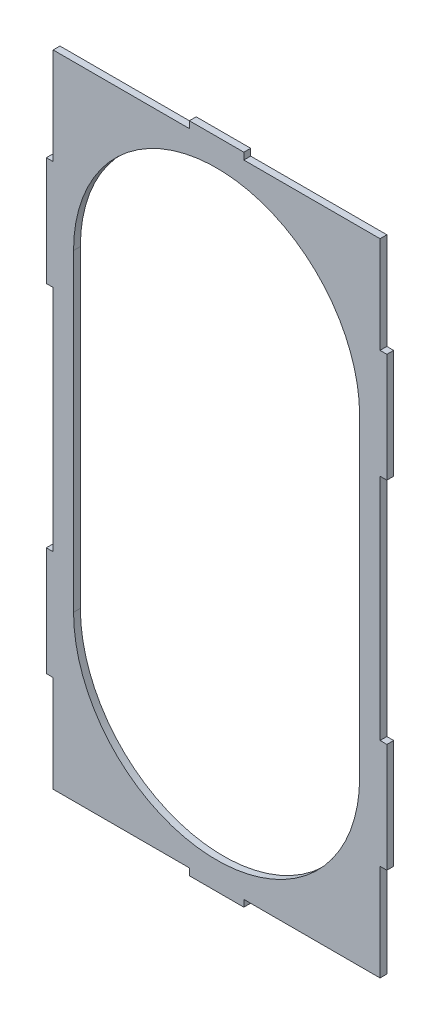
SolidWorks part; units mm, degrees
ref_plane "Front Plane" through (0, 0, 0) normal (0, 0, 1) x (1, 0, 0)
ref_plane "Top Plane" through (0, 0, 0) normal (0, 1, 0) x (1, 0, 0)
ref_plane "Right Plane" through (0, 0, 0) normal (1, 0, 0) x (0, 0, -1)
sketch "Sketch1" plane through (0, 0, 0) normal (0, 0, 1) x (1, 0, 0)
  line L0 (19.985, 58.3032) -> (83.485, 58.3032)
  line L1 (-68.915, 58.3032) -> (-5.415, 58.3032)
  line L2 (-68.915, 58.3032) -> (-68.915, 13.2182)
  line L3 (-68.915, -240.1468) -> (-5.415, -240.1468)
  line L4 (83.485, 58.3032) -> (83.485, 13.2182)
  line L5 (83.485, -37.5818) -> (83.485, -144.2618)
  line L6 (-5.415, 58.3032) -> (-5.415, 61.4782)
  line L7 (-5.415, 61.4782) -> (19.985, 61.4782)
  line L8 (19.985, 58.3032) -> (19.985, 61.4782)
  line L9 (-68.915, 13.2182) -> (-72.09, 13.2182)
  line L10 (-68.915, -195.0618) -> (-68.915, -240.1468)
  line L11 (-68.915, -37.5818) -> (-72.09, -37.5818)
  line L12 (-72.09, 13.2182) -> (-72.09, -37.5818)
  line L13 (-68.915, -144.2618) -> (-72.09, -144.2618)
  line L14 (83.485, -195.0618) -> (83.485, -240.1468)
  line L15 (-68.915, -195.0618) -> (-72.09, -195.0618)
  line L16 (-72.09, -144.2618) -> (-72.09, -195.0618)
  line L17 (83.485, 13.2182) -> (86.66, 13.2182)
  line L18 (-68.915, -37.5818) -> (-68.915, -144.2618)
  line L19 (83.485, -37.5818) -> (86.66, -37.5818)
  line L20 (86.66, 13.2182) -> (86.66, -37.5818)
  line L21 (83.485, -144.2618) -> (86.66, -144.2618)
  line L22 (19.985, -240.1468) -> (83.485, -240.1468)
  line L23 (83.485, -195.0618) -> (86.66, -195.0618)
  line L24 (86.66, -144.2618) -> (86.66, -195.0618)
  line L26 (-5.415, -240.1468) -> (-5.415, -243.3218)
  line L27 (-5.415, -243.3218) -> (19.985, -243.3218)
  line L28 (19.985, -240.1468) -> (19.985, -243.3218)
  line L30 (-59.39, -17.8968) -> (-59.39, -163.9468)
  line L32 (73.96, -17.8968) -> (73.96, -163.9468)
  arc A0 (73.96, -17.8968) -> (-59.39, -17.8968) centre (7.285, -17.8968) ccw
  arc A1 (-59.39, -163.9468) -> (73.96, -163.9468) centre (7.285, -163.9468) ccw
  dimension "D23" = 133.35
  dimension "D24" = 76.2
  dimension "D25" = 133.35
  dimension "D1" = 152.4
  dimension "D2" = 298.45
  dimension "D3" = 25.4
  dimension "D4" = 50.8
  dimension "D5" = 50.8
  dimension "D6" = 50.8
  dimension "D7" = 50.8
  dimension "D8" = 25.4
  dimension "D9" = 3.175
  dimension "D10" = 3.175
  dimension "D11" = 3.175
  dimension "D12" = 3.175
  dimension "D13" = 3.175
  dimension "D14" = 3.175
  dimension "D15" = 63.5
  dimension "D16" = 63.5
  dimension "D17" = 45.085
  dimension "D18" = 45.085
  dimension "D19" = 45.085
  dimension "D20" = 45.085
  dimension "D26" = 76.2
extrude "Boss-Extrude1" add sketch "Sketch1" along normal blind 3.175
